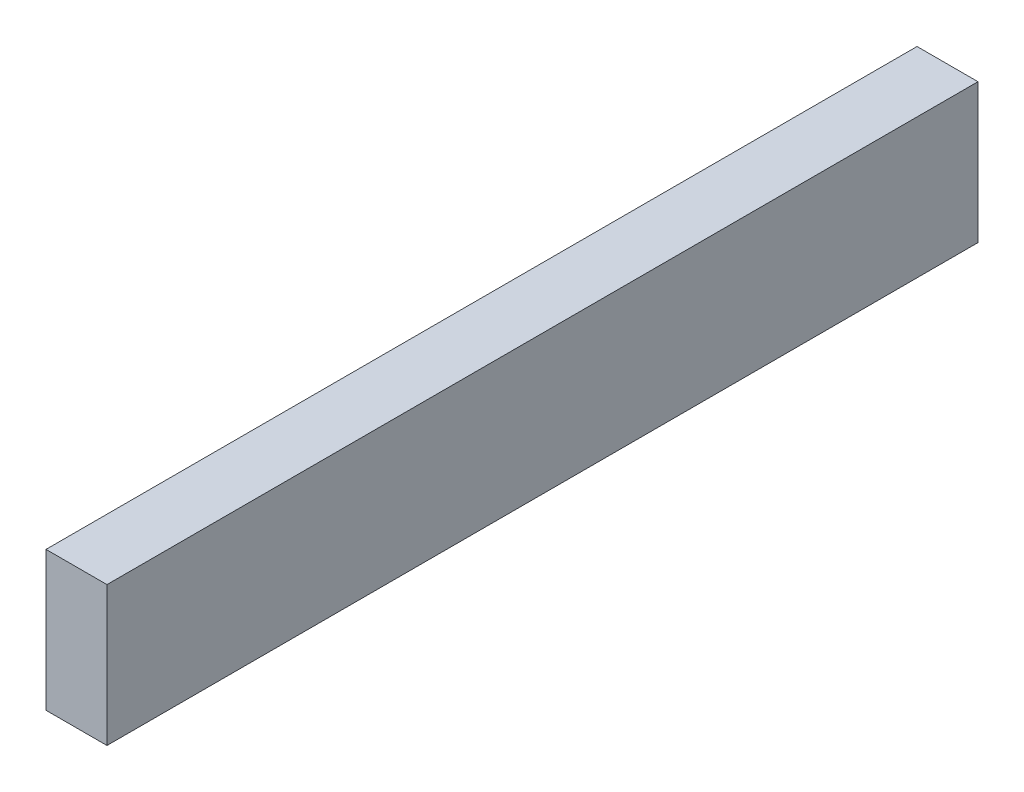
SolidWorks part; units mm, degrees
ref_plane "Face" through (0, 0, 0) normal (0, 0, 1) x (1, 0, 0)
ref_plane "Dessus" through (0, 0, 0) normal (0, 1, 0) x (1, 0, 0)
ref_plane "Droite" through (0, 0, 0) normal (1, 0, 0) x (0, 0, -1)
sketch "Esquisse1" plane through (0, 0, 0) normal (0, 0, 1) x (1, 0, 0)
  line L1 (-58.6347, -18.0919) -> (-44.6347, -18.0919)
  line L2 (-58.6347, -18.0919) -> (-58.6347, -50.0919)
  line L3 (-58.6347, -50.0919) -> (-44.6347, -50.0919)
  line L4 (-44.6347, -18.0919) -> (-44.6347, -50.0919)
  dimension "D1" = 32
  dimension "D2" = 14
extrude "Extrusion1" add sketch "Esquisse1" along normal blind 200
